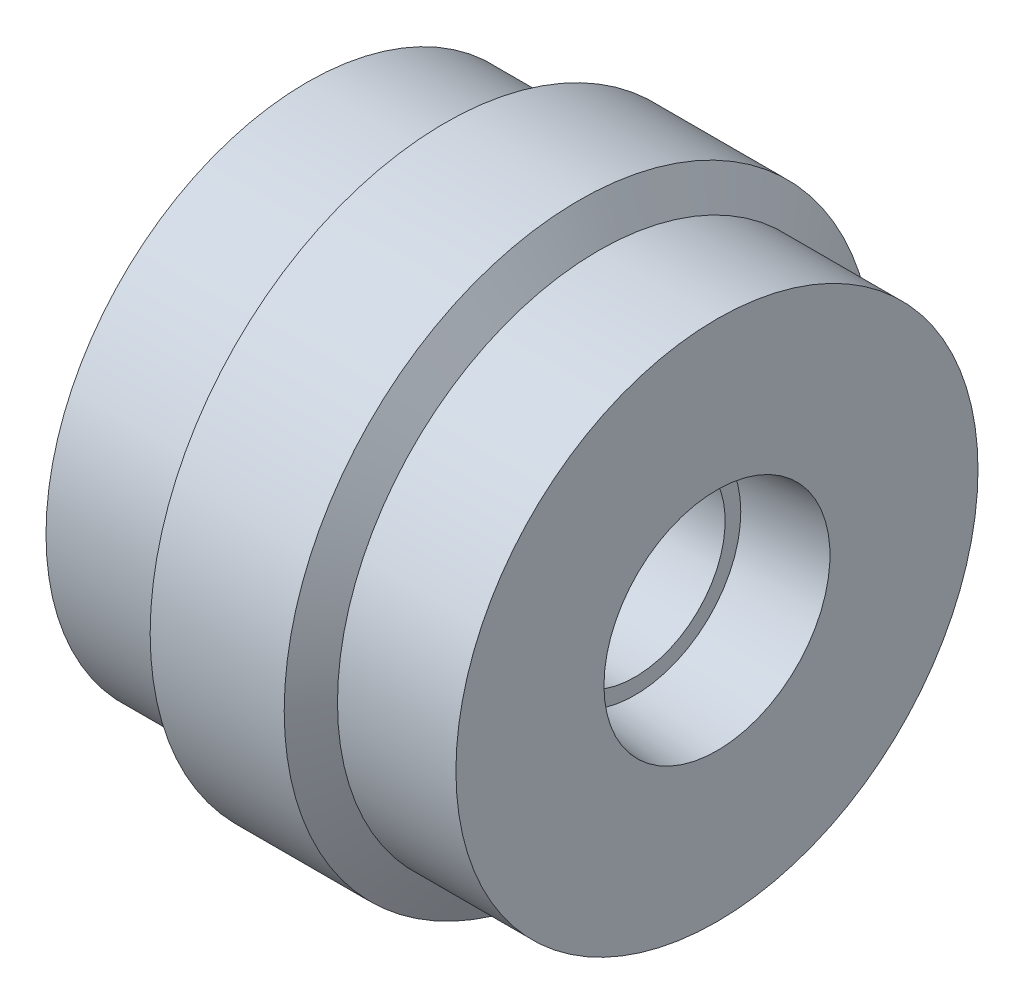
SolidWorks part; units mm, degrees
ref_plane "Front Plane" through (0, 0, 0) normal (0, 0, 1) x (1, 0, 0)
ref_plane "Top Plane" through (0, 0, 0) normal (0, 1, 0) x (1, 0, 0)
ref_plane "Right Plane" through (0, 0, 0) normal (1, 0, 0) x (0, 0, -1)
sketch "Sketch1" plane through (0, 0, 0) normal (0, 0, 1) x (1, 0, 0)
  line L0 (0, 0) -> (0, 42.8753) construction
  line L1 (0, 0) -> (24.9682, 0) construction
  line L2 (24.9682, 0) -> (24.9682, 42.8753) construction
  line L3 (0, 15.9004) -> (7.2136, 15.9004)
  line L4 (7.2136, 15.9004) -> (8.4014, 17.9578)
  line L5 (8.4014, 17.9578) -> (16.5668, 17.9578)
  line L6 (16.5668, 17.9578) -> (17.7546, 15.9004)
  line L7 (17.7546, 15.9004) -> (24.9682, 15.9004)
  line L8 (24.9682, 15.9004) -> (24.9682, 6.8834)
  line L9 (24.9682, 6.8834) -> (19.9682, 6.4516)
  line L10 (19.9682, 6.4516) -> (19.9682, 5.5)
  line L11 (19.9682, 5.5) -> (5, 5.5)
  line L12 (5, 5.5) -> (5, 6.4516)
  line L13 (5, 6.4516) -> (0, 6.8834)
  line L14 (0, 6.8834) -> (0, 15.9004)
  line L15 (12.4841, 0) -> (12.4841, 30.3698) construction
  dimension "D1" = 24.9682
  dimension "D2" = 15.9004
  dimension "D3" = 17.9578
  dimension "D4" = 10.541
  dimension "D5" = 30
  dimension "D6" = 5
  dimension "D7" = 5.5
  dimension "D8" = 6.4516
  dimension "D9" = 6.8834
revolve "Revolve1" add sketch "Sketch1" angle 360 about L1
